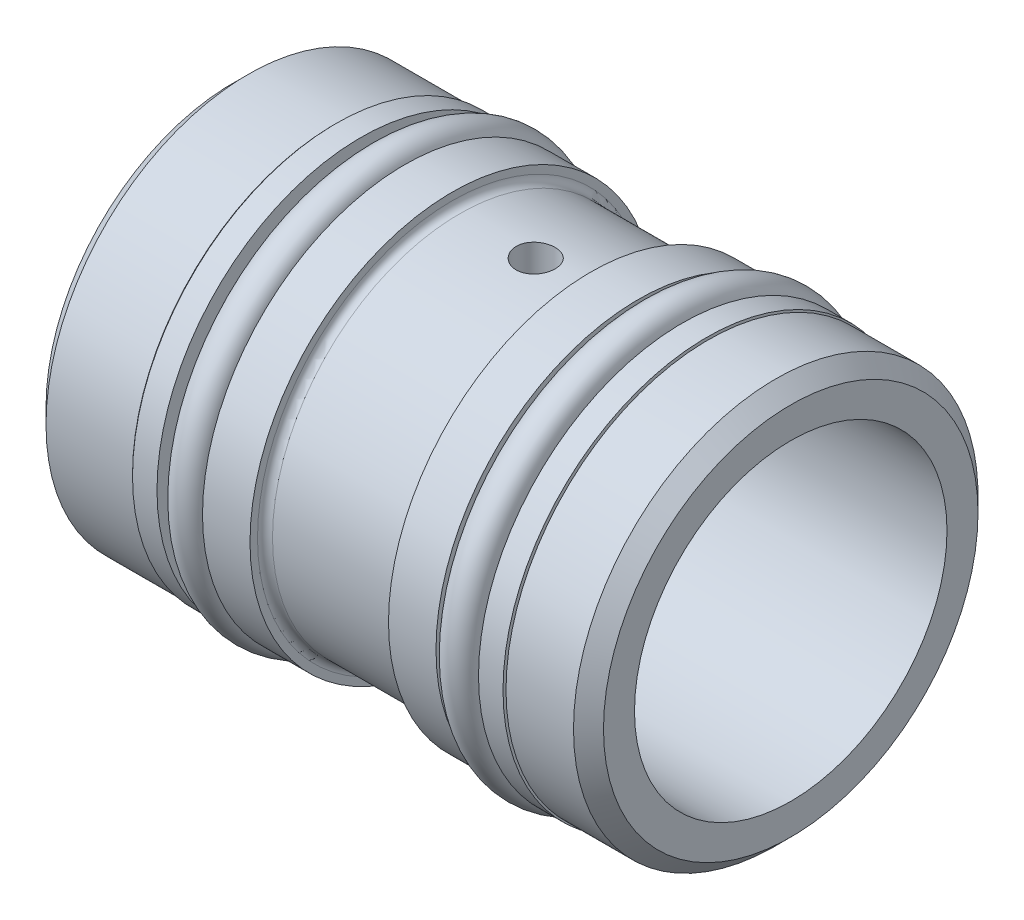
SolidWorks part; units mm, degrees
ref_plane "Front Plane" through (0, 0, 0) normal (0, 0, 1) x (1, 0, 0)
ref_plane "Top Plane" through (0, 0, 0) normal (0, 1, 0) x (1, 0, 0)
ref_plane "Right Plane" through (0, 0, 0) normal (1, 0, 0) x (0, 0, -1)
sketch "Sketch1" plane through (0, 0, 0) normal (0, 0, 1) x (1, 0, 0)
  line L0 (0, 0) -> (0, 45.5562) construction
  line L1 (0, 0) -> (32.8567, 0) construction
  line L2 (-14.1605, 4.7625) -> (-14.1605, 10.2743)
  line L3 (-14.1605, 10.2743) -> (-9.0043, 10.2743)
  line L4 (-9.0043, 10.2743) -> (-9.0043, 9.0043)
  line L5 (-9.0043, 9.0043) -> (-5.4483, 9.0043)
  line L6 (-5.4483, 9.0043) -> (-5.4483, 10.2743)
  line L7 (-5.4483, 10.2743) -> (-3.0353, 10.2743)
  line L8 (-3.0353, 10.2743) -> (-3.0353, 9.5123)
  line L9 (-3.0353, 9.5123) -> (4.0005, 9.5123)
  line L10 (-14.1605, 4.7625) -> (0.0889, 4.7625)
  line L11 (0.0889, 4.7625) -> (0.0889, 7.9375)
  line L12 (0.0889, 7.9375) -> (14.1605, 7.9375)
  line L13 (4.0005, 10.2743) -> (4.0005, 9.5123)
  line L14 (6.4135, 10.2743) -> (4.0005, 10.2743)
  line L15 (6.4135, 9.0043) -> (6.4135, 10.2743)
  line L16 (9.9695, 9.0043) -> (6.4135, 9.0043)
  line L17 (9.9695, 10.2743) -> (9.9695, 9.0043)
  line L18 (14.1605, 10.2743) -> (9.9695, 10.2743)
  line L19 (14.1605, 10.2743) -> (14.1605, 7.9375)
  dimension "D2" = 3.556
  dimension "D3" = 7.0358
  dimension "D4" = 20.5486
  dimension "D5" = 28.321
  dimension "D6" = 15.875
  dimension "D7" = 14.0716
  dimension "D8" = 19.0246
  dimension "D9" = 18.0086
  dimension "D10" = 9.525
  dimension "D11" = 23.1648
  dimension "D12" = 2.413
  dimension "D13" = 2.413
revolve "Revolve1" add sketch "Sketch1" angle 360 about L1
fillet "Fillet1" radius 0.381 2 edges at (4.0005, 0, 9.5123) (-3.0353, 0, 9.5123)
chamfer "Chamfer1" distance 0.762 angle 45 2 edges at (14.1605, 0, 10.2743) (-14.1605, 0, 10.2743)
sketch "Sketch6" plane through (0, 0, 0) normal (0, 0, 1) x (1, 0, 0)
  line L0 (0, 0) -> (49.5791, 0) construction
  line L1 (-14.1605, 9.5123) -> (-14.1605, -9.5123) construction
  line L2 (-5.4483, 9.0043) -> (-9.0043, 9.0043) construction
  line L3 (-8.9281, 9.0043) -> (-7.6835, 9.0043)
  line L4 (-8.9281, 9.0043) -> (-8.9281, 10.3505)
  line L5 (-8.9281, 10.3505) -> (-7.6835, 10.3505)
  line L6 (-7.6835, 9.0043) -> (-7.6835, 10.3505)
  line L7 (0.4826, 41.4439) -> (0.4826, -9.3524) construction
  line L8 (-9.0043, -10.2743) -> (-9.0043, 10.2743) construction
  line L9 (9.9695, 9.0043) -> (9.9695, -9.0043) construction
  line L10 (-5.4483, 10.2743) -> (-5.4483, -10.2743) construction
  line L11 (8.6487, 9.0043) -> (8.6487, 10.3505)
  line L12 (9.8933, 10.3505) -> (8.6487, 10.3505)
  line L13 (9.8933, 9.0043) -> (9.8933, 10.3505)
  line L14 (9.8933, 9.0043) -> (8.6487, 9.0043)
  circle A0 centre (-6.4135, 9.8171) radius 0.889
  circle A1 centre (7.3787, 9.8171) radius 0.889
  dimension "D4" = 1.778
  dimension "D5" = 19.6342
  dimension "D6" = 0.9652
  dimension "D1" = 1.2446
  dimension "D2" = 5.2324
  dimension "D3" = 20.701
revolve "Revolve3" add sketch "Sketch6" angle 360 about L0
sketch "Sketch7" plane through (0, 0, 0) normal (0, 1, 0) x (0, 0, -1)
  line L1 (-9.5123, -14.1605) -> (9.5123, -14.1605) construction
  circle A0 centre (0, -1.2065) radius 0.9906
  dimension "D1" = 1.9812
  dimension "D2" = 12.954
extrude "Cut-Extrude1" cut sketch "Sketch7" against normal through all and the other way through all
